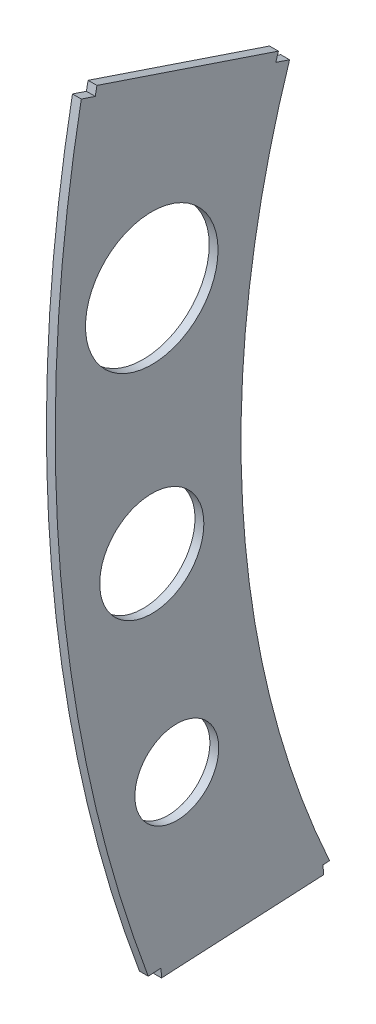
SolidWorks part; units mm, degrees
ref_plane "Front Plane" through (0, 0, 0) normal (0, 0, 1) x (1, 0, 0)
ref_plane "Top Plane" through (0, 0, 0) normal (0, 1, 0) x (1, 0, 0)
ref_plane "Right Plane" through (0, 0, 0) normal (1, 0, 0) x (0, 0, -1)
sketch "Sketch1" plane through (0, 0, 0) normal (1, 0, 0) x (0, 0, -1)
  line L0 (-0.9442, 0.3175) -> (283.4061, -95.3115)
  line L1 (375.733, -1159.6825) -> (115.733, -1159.6825)
  arc A0 (-0.9442, 0.3175) -> (115.733, -1159.6825) centre (1973.7475, -386.9284) ccw
  arc A1 (375.733, -1159.6825) -> (283.4061, -95.3115) centre (1550.8442, -521.5598) cw
  dimension "D1" = 300
  dimension "D2" = 260
  dimension "D3" = 1160
extrude "Boss-Extrude2" add sketch "Sketch1" along normal blind 12
sketch "Sketch2" plane through (12, 0, 0) normal (1, 0, 0) x (0, 0, -1)
  circle A0 centre (92.5146, -281.7476) radius 89.9841
  circle A1 centre (92.5146, -593.879) radius 70.694
  circle A2 centre (126.5008, -867.8251) radius 56.9337
extrude "Cut-Extrude1" cut sketch "Sketch2" against normal blind 14
sketch "Sketch3" plane through (12, 0, 0) normal (1, 0, 0) x (0, 0, -1)
  line L0 (-0.9442, 0.3175) -> (18.0125, -6.0577)
  line L1 (283.4061, -95.3115) -> (-0.9442, 0.3175) construction
  line L2 (18.0125, -6.0577) -> (15.7384, -17.8403)
  line L3 (15.7384, -17.8403) -> (-3.2183, -11.465)
  line L4 (-3.2183, -11.465) -> (-0.9442, 0.3175)
  arc A0 (-0.9442, 0.3175) -> (115.733, -1159.6825) centre (1973.7475, -386.9284) ccw construction
  dimension "D1" = 12
  dimension "D2" = 20
  dimension "D3" = 12
  dimension "D4" = 20
extrude "Cut-Extrude2" cut sketch "Sketch3" against normal blind 14
sketch "Sketch4" plane through (0, 0.1871, 0.9693) normal (0, -0.1895, -0.9819) x (-1, 0, 0)
  line L0 (2.8628, 3.6326) -> (-18.8412, 3.6326)
  line L1 (-18.8412, 3.6326) -> (-18.8412, -13.6431)
  line L4 (2.8628, 3.6326) -> (3.2058, -13.8667)
  line L5 (3.2058, -13.8667) -> (-18.8412, -13.6431)
extrude "Cut-Extrude3" cut sketch "Sketch4" against normal blind 14
sketch "Sketch5" plane through (12, 0, 0) normal (1, 0, 0) x (0, 0, -1)
  line L0 (283.4061, -95.3115) -> (264.4495, -88.9362)
  line L1 (283.4061, -95.3115) -> (18.0125, -6.0577) construction
  line L2 (283.4061, -95.3115) -> (279.914, -106.7921)
  line L3 (264.4495, -88.9362) -> (260.9573, -100.4168)
  line L4 (260.9573, -100.4168) -> (279.914, -106.7921)
  dimension "D1" = 20
  dimension "D2" = 12
  dimension "D3" = 12
  dimension "D4" = 20
extrude "Cut-Extrude4" cut sketch "Sketch5" against normal blind 14
sketch "Sketch6" plane through (12, 0, 0) normal (1, 0, 0) x (0, 0, -1)
  line L0 (115.733, -1159.6825) -> (135.733, -1159.6825)
  line L1 (115.733, -1159.6825) -> (375.733, -1159.6825) construction
  line L2 (135.733, -1159.6825) -> (130.8392, -1145.6825)
  line L3 (115.733, -1159.6825) -> (110.6837, -1146.6248)
  line L4 (130.8392, -1145.6825) -> (110.6837, -1146.6248)
  dimension "D1" = 20
  dimension "D2" = 14
  dimension "D3" = 14
extrude "Cut-Extrude5" cut sketch "Sketch6" against normal blind 14
sketch "Sketch7" plane through (0, -111.9211, 289.4304) normal (0, 0.3607, -0.9327) x (-1, 0, 0)
  line L0 (-12, -1109.3705) -> (3.3722, -1109.3705)
  line L1 (3.3722, -1109.3705) -> (3.3722, -1124.6061)
  line L2 (3.3722, -1124.6061) -> (-19.7085, -1124.6061)
  line L3 (-19.7085, -1124.6061) -> (-19.7085, -1109.3705)
  line L4 (-19.7085, -1109.3705) -> (-12, -1109.3705)
extrude "Cut-Extrude6" cut sketch "Sketch7" against normal blind 14
sketch "Sketch8" plane through (12, 0, 0) normal (1, 0, 0) x (0, 0, -1)
  line L0 (375.733, -1159.6825) -> (355.733, -1159.6825)
  line L1 (135.733, -1159.6825) -> (375.733, -1159.6825) construction
  line L2 (355.733, -1159.6825) -> (349.1199, -1147.3428)
  line L3 (375.733, -1159.6825) -> (369.4698, -1147.1616)
  line L4 (369.4698, -1147.1616) -> (349.1199, -1147.3428)
  dimension "D1" = 20
  dimension "D2" = 14
  dimension "D3" = 14
  dimension "D4" = 20.3498
  dimension "D5" = 20.3498
extrude "Cut-Extrude7" cut sketch "Sketch8" against normal blind 14
sketch "Sketch9" plane through (0, 0, 0) normal (-1, 0, 0) x (0, 0, 1)
  line L0 (-110.4006, -1146.7342) -> (-339.3224, -1087.5119)
  line L1 (-339.3224, -1087.5119) -> (-366.8329, -1146.4031)
  line L2 (-366.8329, -1146.4031) -> (-360.9925, -1205.1486)
  line L3 (-360.9925, -1205.1486) -> (-119.2961, -1181.1194)
  line L4 (-119.2961, -1181.1194) -> (-110.4006, -1146.7342)
  arc A0 (-369.0218, -1147.1656) -> (-279.6336, -106.6978) centre (-1550.8442, -521.5598) ccw construction
  dimension "D1" = 65
extrude "Cut-Extrude8" cut sketch "Sketch9" against normal blind 25
sketch "Sketch10" plane through (0, 0, 0) normal (-1, 0, 0) x (0, 0, 1)
  line L0 (-382.807, -1072.94) -> (-281.0064, -1108.6363)
  line L1 (-281.0064, -1108.6363) -> (-343.8054, -1186.6394)
  line L2 (-343.8054, -1186.6394) -> (-390.7395, -1154.2483)
  line L3 (-390.7395, -1154.2483) -> (-382.807, -1072.94)
extrude "Cut-Extrude9" cut sketch "Sketch10" against normal blind 25
sketch "Sketch11" plane through (0, -64.6899, 138.4802) normal (0, -0.4232, 0.906) x (1, 0, 0)
  line L0 (12, -1128.92) -> (12, -1129.561) construction
  line L1 (0, -1128.92) -> (12, -1128.92)
  line L2 (0, -1128.92) -> (0, -1129.561)
  line L3 (0, -1129.561) -> (12, -1129.561)
  line L4 (12, -1128.92) -> (12, -1129.561)
  line L5 (0, -1129.561) -> (12, -1129.561) construction
extrude "Cut-Extrude10" cut sketch "Sketch11" against normal blind 25
sketch "Sketch12" plane through (0, 0, 0) normal (-1, 0, 0) x (0, 0, 1)
  line L0 (-339.3224, -1087.5119) -> (-92.123, -1100.2698)
  line L1 (-92.123, -1100.2698) -> (-118.1505, -1168.924)
  line L2 (-118.1505, -1168.924) -> (-339.3224, -1087.5119)
  arc A0 (-110.4006, -1146.7342) -> (3.2183, -11.465) centre (-1973.7475, -386.9284) ccw construction
extrude "Cut-Extrude11" cut sketch "Sketch12" against normal blind 25
sketch "Sketch14" plane through (0, 0, 0) normal (-1, 0, 0) x (0, 0, 1)
  line L0 (-325.1034, -1076.2138) -> (-105.1034, -1087.5679)
  line L1 (-92.123, -1100.2698) -> (-339.3224, -1087.5119) construction
  line L2 (-215.7227, -1093.8908) -> (-214.1347, -1063.1217) construction
  line L3 (-105.7227, -1099.5679) -> (-105.1034, -1087.5679)
  line L4 (-325.7227, -1088.2138) -> (-325.1034, -1076.2138)
  line L5 (-325.1034, -1076.2138) -> (-361.2598, -1074.3478)
  line L6 (-105.1034, -1087.5679) -> (-59.3249, -1089.9305)
  line L7 (-361.2598, -1074.3478) -> (-361.2598, -1119.4181)
  line L8 (-325.7227, -1088.2138) -> (-327.1477, -1115.8239)
  line L9 (-327.1477, -1115.8239) -> (-361.2598, -1119.4181)
  line L10 (-105.7227, -1099.5679) -> (-107.5166, -1134.3263)
  line L11 (-59.3249, -1089.9305) -> (-107.5166, -1134.3263)
  dimension "D1" = 12
  dimension "D2" = 90
  dimension "D3" = 90
  dimension "D4" = 110
  dimension "D5" = 12
extrude "Cut-Extrude14" cut sketch "Sketch14" against normal blind 25 contours L4 L5 M17 M10 | L6 L3 M10 M11
sketch "Sketch17" plane through (0, 0, 0) normal (-1, 0, 0) x (0, 0, 1)
  line L1 (-167.5146, -441.7317) -> (-17.5146, -441.7317)
  line L2 (-167.5146, -441.7317) -> (-167.5146, -453.7317)
  line L3 (-167.5146, -453.7317) -> (-17.5146, -453.7317)
  line L4 (-17.5146, -441.7317) -> (-17.5146, -453.7317)
  line L6 (-92.5146, -371.7317) -> (-92.5146, -523.1849) construction
  circle A0 centre (-92.5146, -281.7476) radius 89.9841 construction
  circle A1 centre (-92.5146, -593.879) radius 70.694 construction
  dimension "D1" = 12
  dimension "D2" = 70
  dimension "D3" = 150
  dimension "D4" = 75
extrude "Cut-Extrude17" cut sketch "Sketch17" against normal blind 7
sketch "Sketch18" plane through (0, 0, 0) normal (-1, 0, 0) x (0, 0, 1)
  line L0 (-102.4371, -989.0314) -> (-176.6983, -1056.0036)
  line L2 (-184.735, -1047.0923) -> (-110.4738, -980.1201)
  line L3 (-110.4738, -980.1201) -> (-102.4371, -989.0314)
  line L4 (-105.7227, -1099.5679) -> (-325.7227, -1088.2138) construction
  line L5 (-184.735, -1047.0923) -> (-176.6983, -1056.0036)
  dimension "D1" = 100
  dimension "D2" = 135
  dimension "D3" = 12
  dimension "D4" = 12
extrude "Cut-Extrude18" cut sketch "Sketch18" against normal blind 7
